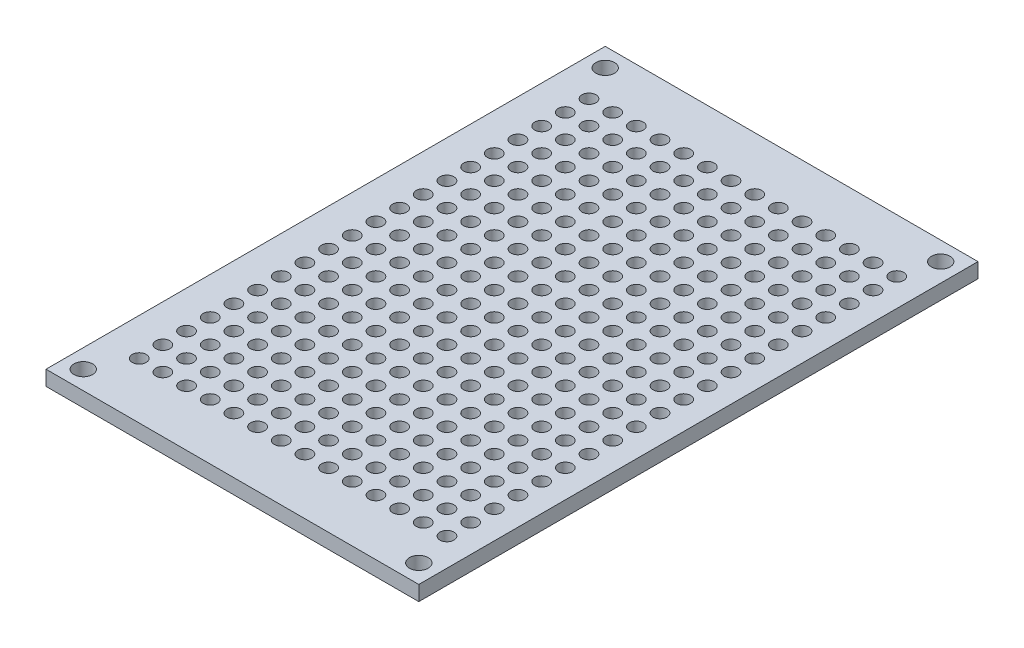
SolidWorks part; units mm, degrees
ref_plane "Front Plane" through (0, 0, 0) normal (0, 0, 1) x (1, 0, 0)
ref_plane "Top Plane" through (0, 0, 0) normal (0, 1, 0) x (1, 0, 0)
ref_plane "Right Plane" through (0, 0, 0) normal (1, 0, 0) x (0, 0, -1)
sketch "Sketch1" plane through (0, 0, 0) normal (0, 1, 0) x (1, 0, 0)
  line L1 (0, 0) -> (40, 0)
  line L2 (0, 0) -> (0, 60)
  line L3 (0, 60) -> (40, 60)
  line L4 (40, 0) -> (40, 60)
  dimension "D1" = 40
  dimension "D2" = 60
extrude "Boss-Extrude1" add sketch "Sketch1" along normal blind 1.6
sketch "Sketch2" plane through (0, 1.6, 0) normal (0, 1, 0) x (1, 0, 0)
  line L0 (20, 0) -> (20, 60) construction
  line L1 (0, 0) -> (40, 0) construction
  line L2 (40, 60) -> (0, 60) construction
  line L3 (20, 60) -> (40, 30) construction
  line L4 (40, 0) -> (40, 60) construction
  line L5 (40, 30) -> (0, 30) construction
  line L6 (0, 60) -> (0, 0) construction
  line L8 (38, 2) -> (2, 2) construction
  line L9 (38, 2) -> (38, 58) construction
  line L10 (38, 58) -> (2, 58) construction
  line L11 (2, 2) -> (2, 58) construction
  line L12 (38, 2) -> (2, 58) construction
  line L13 (38, 58) -> (2, 2) construction
  circle A0 centre (2, 58) radius 1
  circle A1 centre (38, 58) radius 1
  circle A2 centre (2, 2) radius 1
  circle A3 centre (38, 2) radius 1
  point P6 (20, 30)
  dimension "D3" = 2
  dimension "D1" = 2
  dimension "D2" = 2
extrude "Cut-Extrude1" cut sketch "Sketch2" against normal blind 20
sketch "Sketch3" plane through (0, 1.6, 0) normal (0, 1, 0) x (1, 0, 0)
  line L0 (0, 60) -> (0, 0) construction
  line L1 (0, 0) -> (40, 0) construction
  circle A0 centre (4, 6) radius 0.75
  dimension "D2" = 1.5
  dimension "D3" = 6
  dimension "D1" = 4
extrude "Cut-Extrude2" cut sketch "Sketch3" against normal blind 10
pattern_linear "LPattern1" count 20 spacing 2.54 along (0, 0, -1) count 14 spacing 2.54 along (1, 0, 0) of "Cut-Extrude2"
